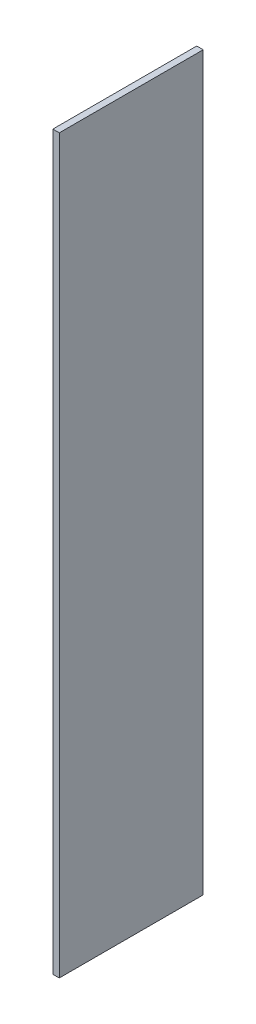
SolidWorks part; units mm, degrees
ref_plane "Front Plane" through (0, 0, 0) normal (0, 0, 1) x (1, 0, 0)
ref_plane "Top Plane" through (0, 0, 0) normal (0, 1, 0) x (1, 0, 0)
ref_plane "Right Plane" through (0, 0, 0) normal (1, 0, 0) x (0, 0, -1)
sketch "Sketch1" plane through (0, 0, 0) normal (1, 0, 0) x (0, 0, -1)
  line L1 (-28.2194, 143.51) -> (28.2194, 143.51)
  line L2 (-28.2194, 143.51) -> (-28.2194, -143.51)
  line L3 (-28.2194, -143.51) -> (28.2194, -143.51)
  line L4 (28.2194, 143.51) -> (28.2194, -143.51)
  line L5 (-28.2194, 143.51) -> (28.2194, -143.51) construction
  line L6 (-28.2194, -143.51) -> (28.2194, 143.51) construction
  point P0 (0, 0)
extrude "Boss-Extrude1" add sketch "Sketch1" along normal blind 2.54
equation "\"motor offset\"=6mm"
equation "\"thickness0.25\"=0.225in"
equation "\"thickness0.125\"=0.122in"
equation "\"thickness_acrylic0.1\"= 0.1in"
equation "\"D1@Sketch1\"=\"thickness_acrylic0.1\"+\"thickness0.125\"+2"
